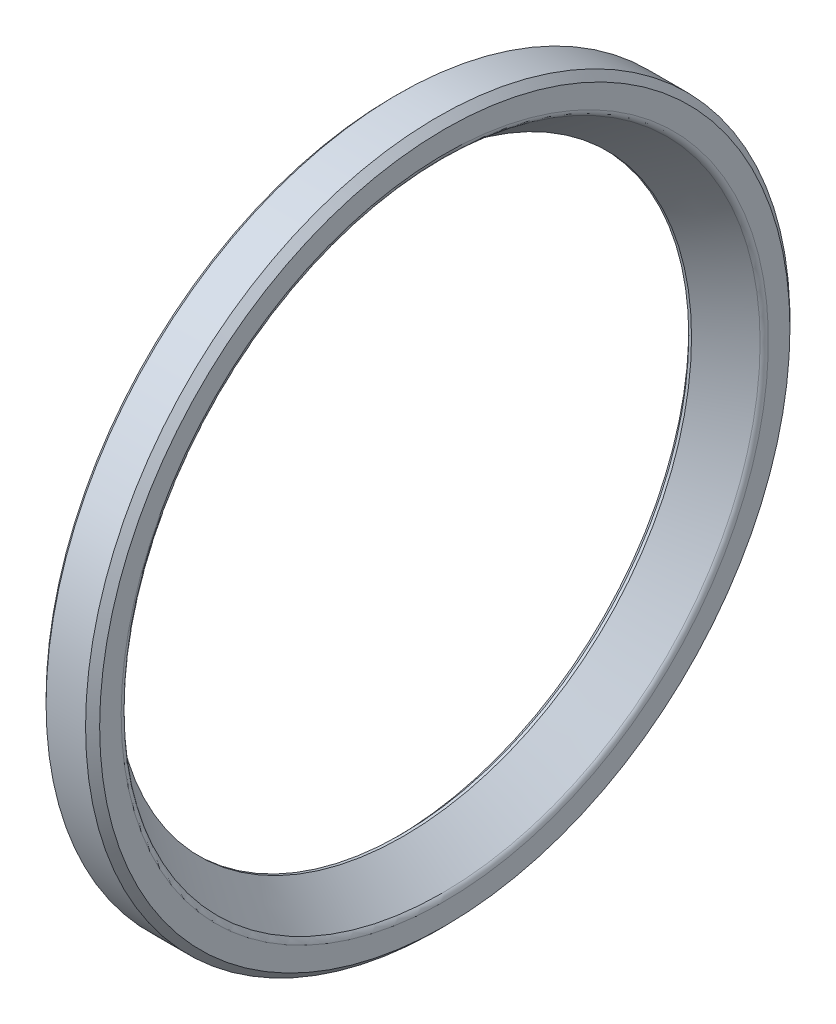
SolidWorks part; units mm, degrees
ref_plane "Plan de face" through (0, 0, 0) normal (0, 0, 1) x (1, 0, 0)
ref_plane "Plan de dessus" through (0, 0, 0) normal (0, 1, 0) x (1, 0, 0)
ref_plane "Plan de droite" through (0, 0, 0) normal (1, 0, 0) x (0, 0, -1)
sketch "Esquisse1" plane through (0, 0, 0) normal (0, 0, 1) x (1, 0, 0)
  line L0 (0, 54.2667) -> (0, 53.0061)
  line L1 (0, 53.0061) -> (0.7333, 52.2727)
  line L2 (0.7333, 52.2727) -> (5.4, 52.2727)
  line L3 (5.6, 52.0727) -> (5.6, 50.0515)
  line L4 (5.558, 49.9701) -> (2.0924, 47.5)
  line L5 (0.9743, 47.5) -> (0.2, 47.5)
  line L6 (0.2, 47.5) -> (0.2, 45.9)
  line L7 (0.2, 45.9) -> (1.1, 45)
  line L8 (1.1, 45) -> (1.5333, 45)
  line L9 (1.5333, 45) -> (7.5728, 49.6697)
  line L10 (8, 50.5399) -> (8, 53.9)
  line L11 (8, 53.9) -> (6.9, 55)
  line L12 (6.9, 55) -> (0.7333, 55)
  line L13 (0.7333, 55) -> (0, 54.2667)
  line L14 (8, 0) -> (0, 0) construction
  arc A0 (5.4, 52.2727) -> (5.6, 52.0727) centre (5.4, 52.0727) cw
  arc A1 (5.6, 50.0515) -> (5.558, 49.9701) centre (5.5, 50.0515) cw
  arc A2 (2.0924, 47.5) -> (0.9743, 47.5) centre (1.5333, 47) ccw
  arc A3 (7.5728, 49.6697) -> (8, 50.5399) centre (6.9, 50.5399) ccw
revolve "Révolution1" add sketch "Esquisse1" angle 360 about L14
sketch "Esquisse4" plane through (8, 0, 0) normal (1, 0, 0) x (0, 0, -1)
  line L1 (-64.6698, 0) -> (73.996, 0)
  line L2 (-64.6698, 0) -> (-64.6698, -76.0821)
  line L3 (-64.6698, -76.0821) -> (73.996, -76.0821)
  line L4 (73.996, 0) -> (73.996, -76.0821)
extrude "Enlèv. mat.-Extru.1" [suppressed] cut sketch "Esquisse4" against normal through all
